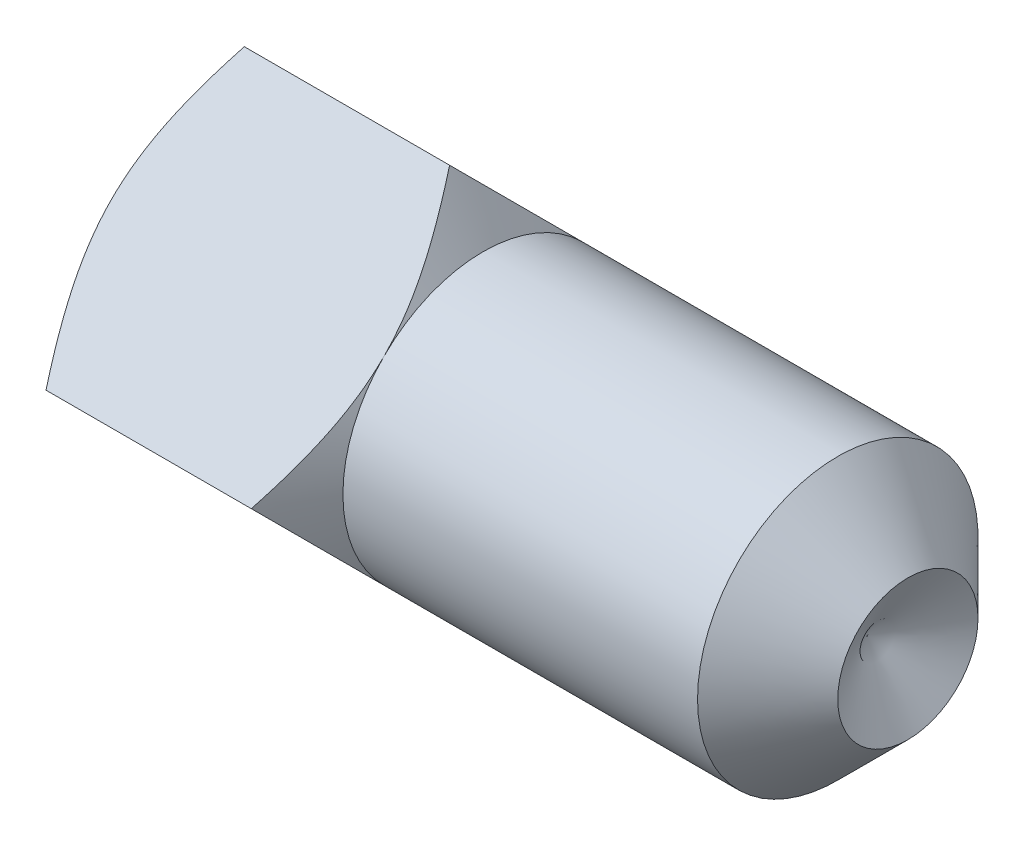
SolidWorks part; units mm, degrees
ref_plane "Front Plane" through (0, 0, 0) normal (0, 0, 1) x (1, 0, 0)
ref_plane "Top Plane" through (0, 0, 0) normal (0, 1, 0) x (1, 0, 0)
ref_plane "Right Plane" through (0, 0, 0) normal (1, 0, 0) x (0, 0, -1)
sketch "BaseHeadSke" plane through (0, 0, 0) normal (1, 0, 0) x (0, 0, -1)
  line L0 (0, 0) -> (14.1701, 0) construction
  line L1 (0, 0) -> (0, 11.9761) construction
  line L2 (0, 2.8284) -> (2.8284, 0)
  line L3 (0, -2.8284) -> (2.8284, 0)
  line L4 (0, 2.8284) -> (-2.8284, 0)
  line L5 (0, -2.8284) -> (-2.8284, 0)
  dimension "D1" = 45
  dimension "Width_flats" = 4
extrude "BaseHead" add sketch "BaseHeadSke" along normal blind 4
sketch "HeadChamferSke" plane through (0, 0, 0) normal (0, 0, 1) x (1, 0, 0)
  line L0 (0, 0) -> (6.1973, 0) construction
  line L1 (2, 2.8284) -> (2, -3.5627) construction
  line L2 (4, 2.8284) -> (0, 2.8284) construction
  line L3 (0, 2.8284) -> (0, 1.9)
  line L4 (0, 2.8284) -> (0.536, 2.8284)
  line L5 (0.536, 2.8284) -> (0, 1.9)
  line L6 (0, 2.8284) -> (0, 0) construction
  line L7 (3.464, 2.8284) -> (4, 1.9)
  line L8 (4, 2.8284) -> (3.464, 2.8284)
  line L9 (4, 2.8284) -> (4, 1.9)
  dimension "Head_chamfer" = 3.8
  dimension "Angle" = 30
revolve "HeadChamfer" cut sketch "HeadChamferSke" angle 360 about L0
sketch "BodySke" plane through (0, 0, 0) normal (0, 0, 1) x (1, 0, 0)
  line L0 (0, 0) -> (13.1857, 0) construction
  line L1 (4, -1.9) -> (4, 1.9) construction
  line L2 (4, 0) -> (4, 1.9) construction
  line L3 (3.464, 2) -> (10, 2)
  line L4 (10, 2) -> (10, 0)
  line L5 (4, 1.9) -> (4, 2) construction
  line L6 (3.464, 2) -> (3.464, 0)
  line L7 (3.464, 0) -> (10, 0)
  line L8 (9.3, 4.69) -> (9.3, -2.048) construction
  point P9 (3.464, 1.61)
  dimension "Diameter" = 4
  dimension "Length" = 6
  dimension "Minor_dia" = 3.22
  dimension "Advance" = 0.7
revolve "BaseBody" add sketch "BodySke" angle 360 about L0
sketch "ChamferEndSke" plane through (0, 0, 0) normal (0, 0, 1) x (1, 0, 0)
  line L0 (0, 0) -> (11.9528, 0) construction
  line L1 (10, 2) -> (10, 1)
  line L2 (10, 1) -> (9, 2)
  line L3 (9, 2) -> (10, 2)
  line L4 (10, 2) -> (3.9423, 2) construction
  line L5 (10, -2) -> (10, 2) construction
  dimension "D1" = 45
  dimension "End_chamfer" = 2
revolve "ChamferEnd" cut sketch "ChamferEndSke" angle 360 about L0
sketch "ThdSchSke" plane through (0, 0, 0) normal (0, 0, 1) x (1, 0, 0)
  line L0 (8.3, 2.4503) -> (8.3, 2)
  line L1 (8.3, 2.4503) -> (8.7503, 2.4503)
  line L2 (8.7503, 2.4503) -> (8.7503, 2)
  line L3 (8.7503, 2) -> (8.5252, 1.61)
  line L4 (8.5252, 1.61) -> (8.3, 2)
  line L5 (0, 0) -> (11.8711, 0) construction
  line L6 (9, 2) -> (3.9423, 2) construction
  dimension "D1" = 0.7
revolve "ThreadSchematic" [suppressed] cut sketch "ThdSchSke" angle 360 about L5
pattern_linear "ThdSchPat" [suppressed] count 6
sketch "CupPointSke" plane through (0, 0, 0) normal (0, 0, 1) x (1, 0, 0)
  line L0 (0, 0) -> (12.971, 0) construction
  line L1 (10, 1) -> (9.4226, 0)
  line L3 (10, 1) -> (10, 0)
  line L4 (10, -1) -> (10, 1) construction
  line L5 (10, 0) -> (9.4226, 0)
  dimension "D1" = 60
revolve "CupPoint" cut sketch "CupPointSke" angle 360 about L0
equation "\"Minor_dia@ThreadCosmetic\" = \"Minor_dia@BodySke\""
equation "\"D1@ThdSchSke\" = \"Advance@BodySke\""
equation "\"Advance@ThdSchPat\" = \"Advance@BodySke\""
equation "\"D1@ThdSchPat\" =  int( (  \"Length@BodySke\" -  ( \"Diameter@BodySke\" - \"End_chamfer@ChamferEndSke\" )  / 2 )  /\"Advance@ThdSchPat\" )  - 1"
